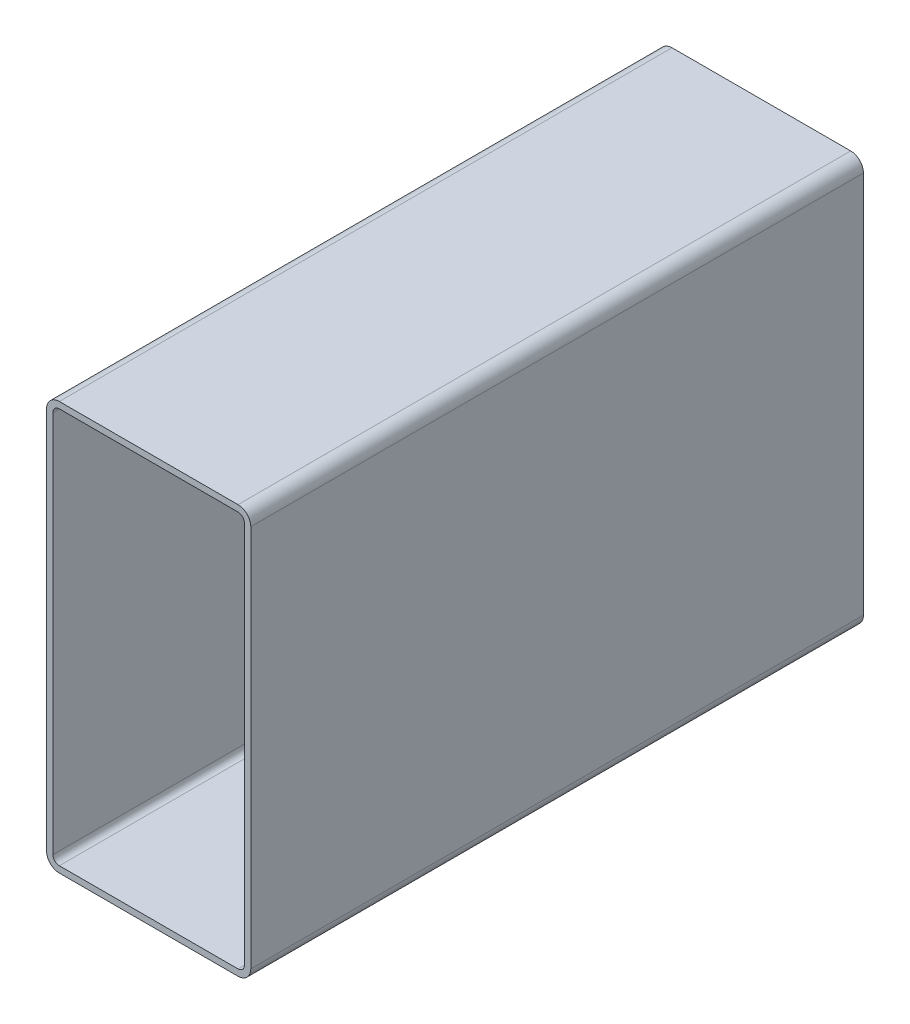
SolidWorks part; units mm, degrees
ref_plane "Front Plane" through (0, 0, 0) normal (0, 0, 1) x (1, 0, 0)
ref_plane "Top Plane" through (0, 0, 0) normal (0, 1, 0) x (1, 0, 0)
ref_plane "Right Plane" through (0, 0, 0) normal (1, 0, 0) x (0, 0, -1)
sketch "Sketch1" plane through (0, 0, 0) normal (0, 0, 1) x (1, 0, 0)
sketch_block_instance "HSS8x4x0.125-1"
sketch_block "HSS8x4x0.125"
extrude "Boss-Extrude1" add sketch "Sketch1" along normal blind 304.8
